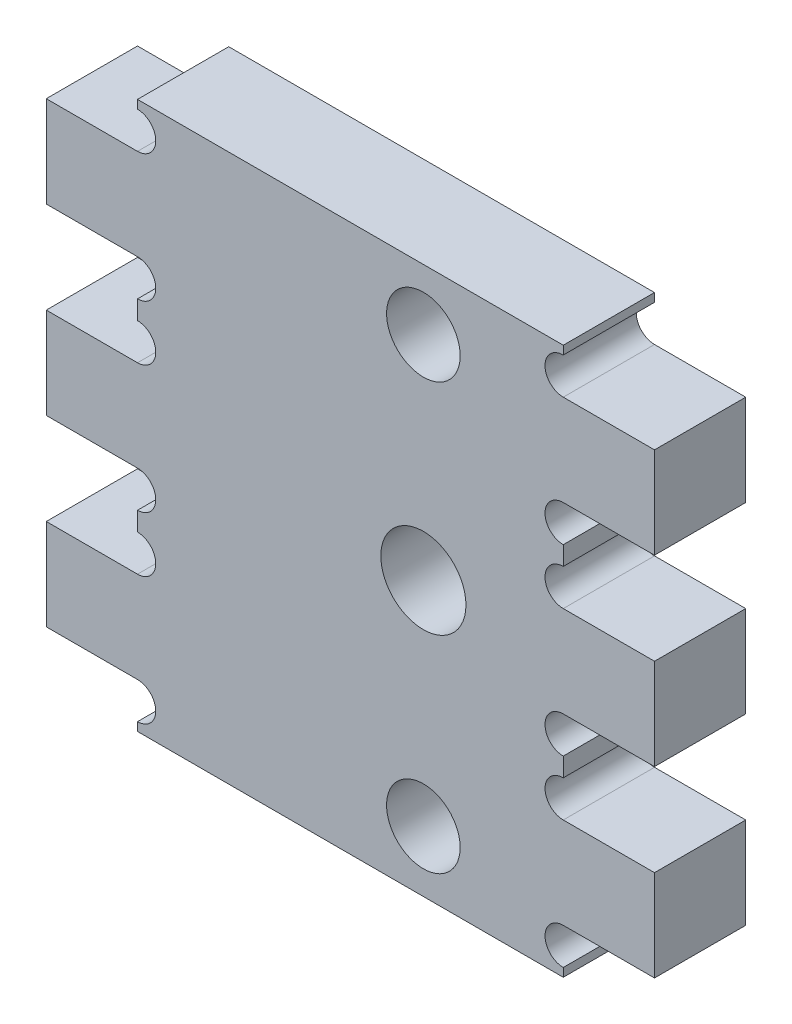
SolidWorks part; units mm, degrees
ref_plane "Ebene vorne" through (0, 0, 0) normal (0, 0, 1) x (1, 0, 0)
ref_plane "Ebene oben" through (0, 0, 0) normal (0, 1, 0) x (1, 0, 0)
ref_plane "Ebene rechts" through (0, 0, 0) normal (1, 0, 0) x (0, 0, -1)
sketch "Skizze1" plane through (0, 0, 0) normal (0, 0, 1) x (1, 0, 0)
  line L0 (96.5881, 0) -> (26.5881, 0)
  line L1 (96.5881, 0) -> (96.5881, 1.4)
  line L2 (26.5881, 0) -> (26.5881, 1.4)
  line L3 (26.5881, 90) -> (96.5881, 90)
  line L5 (111.5881, 7.4) -> (111.5881, 22.4)
  line L6 (111.5881, 22.4) -> (96.5881, 22.4)
  line L7 (111.5881, 7.4) -> (96.5881, 7.4)
  line L8 (96.5881, 37.5) -> (111.5881, 37.5)
  line L9 (111.5881, 37.5) -> (111.5881, 52.5)
  line L10 (111.5881, 52.5) -> (96.5881, 52.5)
  line L11 (96.5881, 67.6) -> (111.5881, 67.6)
  line L12 (111.5881, 67.6) -> (111.5881, 82.6)
  line L13 (111.5881, 82.6) -> (96.5881, 82.6)
  line L14 (96.5881, 90) -> (96.5881, 88.6)
  line L15 (96.5881, 61.6) -> (96.5881, 58.5)
  line L16 (96.5881, 31.5) -> (96.5881, 28.4)
  line L17 (26.5881, 7.4) -> (11.5881, 7.4)
  line L18 (11.5881, 7.4) -> (11.5881, 22.4)
  line L19 (11.5881, 22.4) -> (26.5881, 22.4)
  line L20 (26.5881, 37.5) -> (11.5881, 37.5)
  line L21 (11.5881, 37.5) -> (11.5881, 52.5)
  line L22 (11.5881, 52.5) -> (26.5881, 52.5)
  line L23 (26.5881, 67.6) -> (11.5881, 67.6)
  line L24 (11.5881, 67.6) -> (11.5881, 82.6)
  line L25 (11.5881, 82.6) -> (26.5881, 82.6)
  line L26 (26.5881, 90) -> (26.5881, 88.6)
  line L27 (26.5881, 61.6) -> (26.5881, 58.5)
  line L29 (26.5881, 31.5) -> (26.5881, 28.4)
  arc A0 (96.5881, 88.6) -> (96.5881, 82.6) centre (96.5881, 85.6) ccw
  arc A1 (96.5881, 67.6) -> (96.5881, 61.6) centre (96.5881, 64.6) ccw
  arc A2 (96.5881, 58.5) -> (96.5881, 52.5) centre (96.5881, 55.5) ccw
  arc A3 (96.5881, 37.5) -> (96.5881, 31.5) centre (96.5881, 34.5) ccw
  arc A4 (96.5881, 28.4) -> (96.5881, 22.4) centre (96.5881, 25.4) ccw
  arc A5 (96.5881, 7.4) -> (96.5881, 1.4) centre (96.5881, 4.4) ccw
  arc A6 (26.5881, 88.6) -> (26.5881, 82.6) centre (26.5881, 85.6) cw
  arc A7 (26.5881, 67.6) -> (26.5881, 61.6) centre (26.5881, 64.6) cw
  arc A8 (26.5881, 58.5) -> (26.5881, 52.5) centre (26.5881, 55.5) cw
  arc A9 (26.5881, 37.5) -> (26.5881, 31.5) centre (26.5881, 34.5) cw
  arc A10 (26.5881, 28.4) -> (26.5881, 22.4) centre (26.5881, 25.4) cw
  arc A11 (26.5881, 7.4) -> (26.5881, 1.4) centre (26.5881, 4.4) cw
  dimension "D13" = 7.4
  dimension "D14" = 15.1
  dimension "D15" = 7.4
  dimension "D16" = 15
  dimension "D17" = 3
  dimension "D18" = 3
  dimension "D9" = 15
  dimension "D10" = 15
  dimension "D6" = 3
  dimension "D26" = 15
  dimension "D19" = 3
  dimension "D20" = 3
  dimension "D5" = 3
  dimension "D27" = 15.1
  dimension "D28" = 15
  dimension "D2" = 3
  dimension "D4" = 3
  dimension "D7" = 3
  dimension "D8" = 3
  dimension "D21" = 3
  dimension "D22" = 3
  dimension "D1" = 70
  dimension "D11" = 15
  dimension "D12" = 15.1
  dimension "D23" = 15
  dimension "D24" = 15
  dimension "D25" = 15
  dimension "D29" = 15.1
  dimension "D30" = 7.4
  dimension "D31" = 15
  dimension "D32" = 15
  dimension "D33" = 15
  dimension "D34" = 90
  dimension "D35" = 15
  dimension "D36" = 15
  dimension "D37" = 15
  dimension "D38" = 15
  dimension "D39" = 15
extrude "outline" add sketch "Skizze1" along normal blind 15
sketch "Skizze2" plane through (0, 0, 15) normal (0, 0, 1) x (1, 0, 0)
  line L0 (96.5881, 88.6) -> (96.5881, 90) construction
  line L2 (96.5881, 90) -> (26.5881, 90) construction
  circle A0 centre (73.5881, 80) radius 6.05
  circle A31 centre (73.5881, 45) radius 7
  circle A32 centre (73.5881, 10) radius 6.05
  dimension "D38" = 14
  dimension "D39" = 12.1
  dimension "D6" = 12.1
  dimension "D1" = 35
  dimension "D2" = 23
  dimension "D7" = 70
  dimension "D8" = 10
extrude "inner" cut sketch "Skizze2" against normal blind 15 contours A0
equation "\"R3\"=1.76067"
